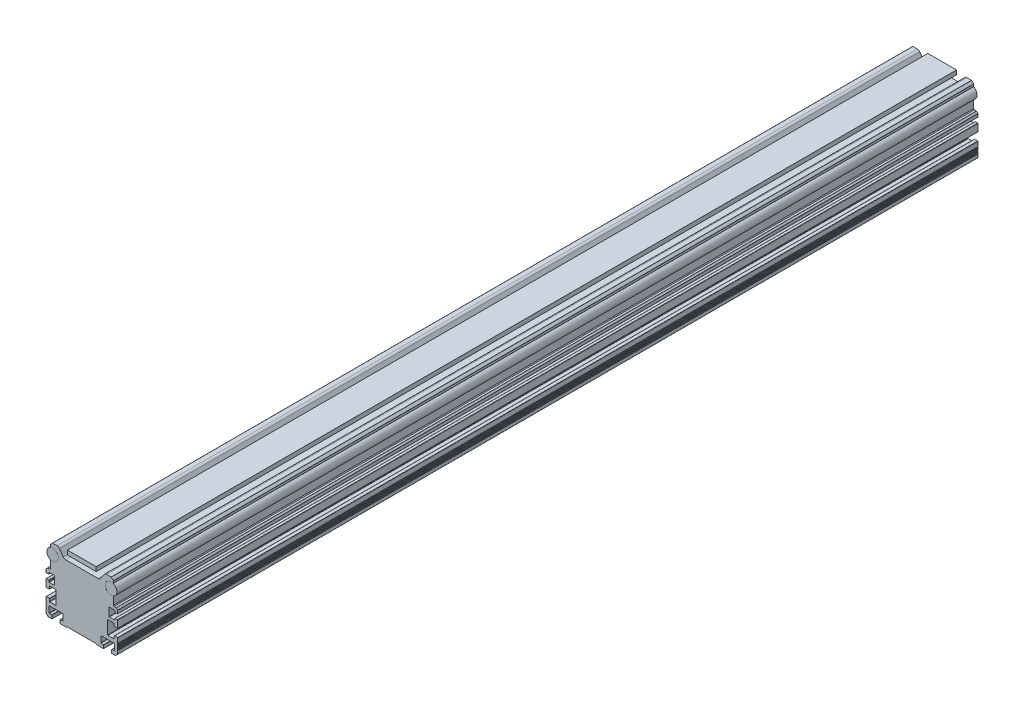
SolidWorks part; units mm, degrees
ref_plane "前视基准面" through (0, 0, 0) normal (0, 0, 1) x (1, 0, 0)
ref_plane "上视基准面" through (0, 0, 0) normal (0, 1, 0) x (1, 0, 0)
ref_plane "右视基准面" through (0, 0, 0) normal (1, 0, 0) x (0, 0, -1)
sketch "草图2" plane through (0, 0, 0) normal (0, 0, 1) x (1, 0, 0)
  line L0 (4.0128, 22.0525) -> (4.0128, 16.7123)
  line L1 (4.0128, 16.7123) -> (3.5128, 16.2123)
  line L2 (3.5128, 16.2123) -> (2.0957, 16.2123)
  line L3 (1.9542, 16.1537) -> (1.0714, 15.2708)
  line L4 (1.0128, 15.1294) -> (1.0128, 13.1062)
  line L5 (1.0128, 9.2062) -> (1.0128, 4.2623)
  line L6 (1.2128, 4.0623) -> (3.3128, 4.0623)
  line L7 (3.5128, 4.2623) -> (3.5128, 5.8618)
  line L8 (3.7128, 6.0623) -> (7.8128, 6.0623)
  line L9 (8.0128, 5.8623) -> (8.0128, -3.2377)
  line L10 (7.8128, -3.4377) -> (3.7128, -3.4377)
  line L11 (3.5128, -3.2371) -> (3.5128, -1.6377)
  line L12 (3.3128, -1.4377) -> (1.2128, -1.4377)
  line L13 (1.0128, -1.6377) -> (1.0128, -11.4049)
  line L14 (1.0714, -11.5463) -> (2.4542, -12.9292)
  line L15 (2.5957, -12.9877) -> (5.0628, -12.9877)
  line L16 (5.2628, -12.7877) -> (5.2628, -10.6877)
  line L17 (5.0628, -10.4877) -> (3.4628, -10.4877)
  line L18 (3.2628, -10.2877) -> (3.2628, -6.1877)
  line L19 (3.4628, -5.9877) -> (12.5628, -5.9877)
  line L20 (12.7628, -6.1877) -> (12.7628, -10.2877)
  line L21 (12.5628, -10.4877) -> (10.9628, -10.4877)
  line L22 (10.7628, -10.6877) -> (10.7628, -12.7877)
  line L23 (10.9628, -12.9877) -> (15.43, -12.9877)
  line L24 (15.5714, -12.9292) -> (16.0128, -12.4877)
  line L25 (16.0128, -12.4877) -> (26.0128, -12.4877)
  line L26 (26.0128, 27.5123) -> (14.669, 27.5123)
  line L27 (13.0307, 28.3651) -> (10.3739, 32.1594)
  line L28 (8.7356, 33.0123) -> (5.5957, 33.0123)
  line L29 (5.4542, 32.9537) -> (4.0714, 31.5708)
  line L30 (4.0128, 31.4294) -> (4.0128, 29.9721)
  line L46 (1.2128, 12.9062) -> (2.8128, 12.9062)
  line L47 (3.0128, 13.9562) -> (3.0128, 13.1062)
  line L48 (3.0128, 9.2062) -> (3.0128, 8.3562)
  line L49 (7.0128, 13.9562) -> (7.0128, 8.3562)
  line L50 (2.8128, 9.4062) -> (1.2128, 9.4062)
  line L51 (3.2128, 8.1562) -> (6.8128, 8.1562)
  line L52 (3.2128, 14.1562) -> (6.8128, 14.1562)
  line L53 (48.0128, 22.0525) -> (48.0128, 16.7123)
  line L54 (48.0128, 16.7123) -> (48.5128, 16.2123)
  line L55 (48.5128, 16.2123) -> (49.93, 16.2123)
  line L56 (50.0714, 16.1537) -> (50.9542, 15.2708)
  line L57 (51.0128, 15.1294) -> (51.0128, 13.1062)
  line L58 (51.0128, 9.2062) -> (51.0128, 4.2623)
  line L59 (50.8128, 4.0623) -> (48.7128, 4.0623)
  line L60 (48.5128, 4.2623) -> (48.5128, 5.8618)
  line L61 (48.3128, 6.0623) -> (44.2128, 6.0623)
  line L62 (44.0128, 5.8623) -> (44.0128, -3.2377)
  line L63 (44.2128, -3.4377) -> (48.3128, -3.4377)
  line L64 (48.5128, -3.2371) -> (48.5128, -1.6377)
  line L65 (48.7128, -1.4377) -> (50.8128, -1.4377)
  line L66 (51.0128, -1.6377) -> (51.0128, -11.4049)
  line L67 (50.9542, -11.5463) -> (49.5714, -12.9292)
  line L68 (49.43, -12.9877) -> (46.9628, -12.9877)
  line L69 (46.7628, -12.7877) -> (46.7628, -10.6877)
  line L70 (46.9628, -10.4877) -> (48.5628, -10.4877)
  line L71 (48.7628, -10.2877) -> (48.7628, -6.1877)
  line L72 (48.5628, -5.9877) -> (39.4628, -5.9877)
  line L73 (39.2628, -6.1877) -> (39.2628, -10.2877)
  line L74 (39.4628, -10.4877) -> (41.0628, -10.4877)
  line L75 (41.2628, -10.6877) -> (41.2628, -12.7877)
  line L76 (41.0628, -12.9877) -> (36.5957, -12.9877)
  line L77 (36.4542, -12.9292) -> (36.0128, -12.4877)
  line L78 (36.0128, -12.4877) -> (26.0128, -12.4877)
  line L79 (26.0128, 27.5123) -> (37.3566, 27.5123)
  line L80 (38.9949, 28.3651) -> (41.6518, 32.1594)
  line L81 (43.2901, 33.0123) -> (46.43, 33.0123)
  line L82 (46.5714, 32.9537) -> (47.9542, 31.5708)
  line L83 (48.0128, 31.4294) -> (48.0128, 29.9721)
  line L99 (50.8128, 12.9062) -> (49.2128, 12.9062)
  line L100 (49.0128, 13.9562) -> (49.0128, 13.1062)
  line L101 (49.0128, 9.2062) -> (49.0128, 8.3562)
  line L102 (45.0128, 13.9562) -> (45.0128, 8.3562)
  line L103 (49.2128, 9.4062) -> (50.8128, 9.4062)
  line L104 (48.8128, 8.1562) -> (45.2128, 8.1562)
  line L105 (48.8128, 14.1562) -> (45.2128, 14.1562)
  arc A0 (4.2795, 22.241) -> (8.7029, 23.4724) centre (5.6128, 26.0123) ccw
  arc A1 (8.9955, 23.8775) -> (8.9955, 28.147) centre (5.6128, 26.0123) ccw
  arc A2 (8.7029, 28.5522) -> (4.2795, 29.7835) centre (5.6128, 26.0123) ccw
  arc A3 (4.2795, 22.241) -> (4.0128, 22.0525) centre (4.2128, 22.0525) ccw
  arc A4 (2.0957, 16.2123) -> (1.9542, 16.1537) centre (2.0957, 16.0123) ccw
  arc A5 (1.0714, 15.2708) -> (1.0128, 15.1294) centre (1.2128, 15.1294) ccw
  arc A6 (1.0128, 13.1062) -> (1.2128, 12.9062) centre (1.2128, 13.1062) ccw
  arc A7 (1.2128, 9.4062) -> (1.0128, 9.2062) centre (1.2128, 9.2062) ccw
  arc A8 (1.0128, 4.2623) -> (1.2128, 4.0623) centre (1.2128, 4.2623) ccw
  arc A9 (3.3128, 4.0623) -> (3.5128, 4.2623) centre (3.3128, 4.2623) ccw
  arc A10 (3.7128, 6.0623) -> (3.5128, 5.8618) centre (3.7128, 5.8623) ccw
  arc A11 (8.0128, 5.8623) -> (7.8128, 6.0623) centre (7.8128, 5.8623) ccw
  arc A12 (7.8128, -3.4377) -> (8.0128, -3.2377) centre (7.8128, -3.2377) ccw
  arc A13 (3.5128, -3.2371) -> (3.7128, -3.4377) centre (3.7128, -3.2377) ccw
  arc A14 (3.5128, -1.6377) -> (3.3128, -1.4377) centre (3.3128, -1.6377) ccw
  arc A15 (1.2128, -1.4377) -> (1.0128, -1.6377) centre (1.2128, -1.6377) ccw
  arc A16 (1.0128, -11.4049) -> (1.0714, -11.5463) centre (1.2128, -11.4049) ccw
  arc A17 (2.4542, -12.9292) -> (2.5957, -12.9877) centre (2.5957, -12.7877) ccw
  arc A18 (5.0628, -12.9877) -> (5.2628, -12.7877) centre (5.0628, -12.7877) ccw
  arc A19 (5.2628, -10.6877) -> (5.0628, -10.4877) centre (5.0628, -10.6877) ccw
  arc A20 (3.2628, -10.2877) -> (3.4628, -10.4877) centre (3.4628, -10.2877) ccw
  arc A21 (3.4628, -5.9877) -> (3.2628, -6.1877) centre (3.4628, -6.1877) ccw
  arc A22 (12.7628, -6.1877) -> (12.5628, -5.9877) centre (12.5628, -6.1877) ccw
  arc A23 (12.5628, -10.4877) -> (12.7628, -10.2877) centre (12.5628, -10.2877) ccw
  arc A24 (10.9628, -10.4877) -> (10.7628, -10.6877) centre (10.9628, -10.6877) ccw
  arc A25 (10.7628, -12.7877) -> (10.9628, -12.9877) centre (10.9628, -12.7877) ccw
  arc A26 (15.43, -12.9877) -> (15.5714, -12.9292) centre (15.43, -12.7877) ccw
  arc A27 (13.0307, 28.3651) -> (14.669, 27.5123) centre (14.669, 29.5123) ccw
  arc A28 (10.3739, 32.1594) -> (8.7356, 33.0123) centre (8.7356, 31.0123) ccw
  arc A29 (5.5957, 33.0123) -> (5.4542, 32.9537) centre (5.5957, 32.8123) ccw
  arc A30 (4.0714, 31.5708) -> (4.0128, 31.4294) centre (4.2128, 31.4294) ccw
  arc A31 (4.0128, 29.9721) -> (4.2795, 29.7835) centre (4.2128, 29.9721) ccw
  arc A49 (2.8128, 12.9062) -> (3.0128, 13.1062) centre (2.8128, 13.1062) ccw
  arc A50 (3.2128, 14.1562) -> (3.0128, 13.9562) centre (3.2128, 13.9562) ccw
  arc A51 (3.0128, 9.2062) -> (2.8128, 9.4062) centre (2.8128, 9.2062) ccw
  arc A52 (6.8128, 8.1562) -> (7.0128, 8.3562) centre (6.8128, 8.3562) ccw
  arc A53 (3.0128, 8.3562) -> (3.2128, 8.1562) centre (3.2128, 8.3562) ccw
  arc A54 (7.0128, 13.9562) -> (6.8128, 14.1562) centre (6.8128, 13.9562) ccw
  arc A55 (8.7029, 23.4724) -> (8.9955, 23.8775) centre (8.8556, 23.6704) ccw
  arc A56 (8.9955, 28.147) -> (8.7029, 28.5522) centre (8.8556, 28.3542) ccw
  arc A57 (43.3227, 23.4724) -> (47.7462, 22.241) centre (46.4128, 26.0123) ccw
  arc A58 (43.0301, 28.147) -> (43.0301, 23.8775) centre (46.4128, 26.0123) ccw
  arc A59 (47.7462, 29.7835) -> (43.3227, 28.5522) centre (46.4128, 26.0123) ccw
  arc A60 (48.0128, 22.0525) -> (47.7462, 22.241) centre (47.8128, 22.0525) ccw
  arc A61 (50.0714, 16.1537) -> (49.93, 16.2123) centre (49.93, 16.0123) ccw
  arc A62 (51.0128, 15.1294) -> (50.9542, 15.2708) centre (50.8128, 15.1294) ccw
  arc A63 (50.8128, 12.9062) -> (51.0128, 13.1062) centre (50.8128, 13.1062) ccw
  arc A64 (51.0128, 9.2062) -> (50.8128, 9.4062) centre (50.8128, 9.2062) ccw
  arc A65 (50.8128, 4.0623) -> (51.0128, 4.2623) centre (50.8128, 4.2623) ccw
  arc A66 (48.5128, 4.2623) -> (48.7128, 4.0623) centre (48.7128, 4.2623) ccw
  arc A67 (48.5128, 5.8618) -> (48.3128, 6.0623) centre (48.3128, 5.8623) ccw
  arc A68 (44.2128, 6.0623) -> (44.0128, 5.8623) centre (44.2128, 5.8623) ccw
  arc A69 (44.0128, -3.2377) -> (44.2128, -3.4377) centre (44.2128, -3.2377) ccw
  arc A70 (48.3128, -3.4377) -> (48.5128, -3.2371) centre (48.3128, -3.2377) ccw
  arc A71 (48.7128, -1.4377) -> (48.5128, -1.6377) centre (48.7128, -1.6377) ccw
  arc A72 (51.0128, -1.6377) -> (50.8128, -1.4377) centre (50.8128, -1.6377) ccw
  arc A73 (50.9542, -11.5463) -> (51.0128, -11.4049) centre (50.8128, -11.4049) ccw
  arc A74 (49.43, -12.9877) -> (49.5714, -12.9292) centre (49.43, -12.7877) ccw
  arc A75 (46.7628, -12.7877) -> (46.9628, -12.9877) centre (46.9628, -12.7877) ccw
  arc A76 (46.9628, -10.4877) -> (46.7628, -10.6877) centre (46.9628, -10.6877) ccw
  arc A77 (48.5628, -10.4877) -> (48.7628, -10.2877) centre (48.5628, -10.2877) ccw
  arc A78 (48.7628, -6.1877) -> (48.5628, -5.9877) centre (48.5628, -6.1877) ccw
  arc A79 (39.4628, -5.9877) -> (39.2628, -6.1877) centre (39.4628, -6.1877) ccw
  arc A80 (39.2628, -10.2877) -> (39.4628, -10.4877) centre (39.4628, -10.2877) ccw
  arc A81 (41.2628, -10.6877) -> (41.0628, -10.4877) centre (41.0628, -10.6877) ccw
  arc A82 (41.0628, -12.9877) -> (41.2628, -12.7877) centre (41.0628, -12.7877) ccw
  arc A83 (36.4542, -12.9292) -> (36.5957, -12.9877) centre (36.5957, -12.7877) ccw
  arc A84 (37.3566, 27.5123) -> (38.9949, 28.3651) centre (37.3566, 29.5123) ccw
  arc A85 (43.2901, 33.0123) -> (41.6518, 32.1594) centre (43.2901, 31.0123) ccw
  arc A86 (46.5714, 32.9537) -> (46.43, 33.0123) centre (46.43, 32.8123) ccw
  arc A87 (48.0128, 31.4294) -> (47.9542, 31.5708) centre (47.8128, 31.4294) ccw
  arc A88 (47.7462, 29.7835) -> (48.0128, 29.9721) centre (47.8128, 29.9721) ccw
  arc A106 (49.0128, 13.1062) -> (49.2128, 12.9062) centre (49.2128, 13.1062) ccw
  arc A107 (49.0128, 13.9562) -> (48.8128, 14.1562) centre (48.8128, 13.9562) ccw
  arc A108 (49.2128, 9.4062) -> (49.0128, 9.2062) centre (49.2128, 9.2062) ccw
  arc A109 (45.0128, 8.3562) -> (45.2128, 8.1562) centre (45.2128, 8.3562) ccw
  arc A110 (48.8128, 8.1562) -> (49.0128, 8.3562) centre (48.8128, 8.3562) ccw
  arc A111 (45.2128, 14.1562) -> (45.0128, 13.9562) centre (45.2128, 13.9562) ccw
  arc A112 (43.0301, 23.8775) -> (43.3227, 23.4724) centre (43.1701, 23.6704) ccw
  arc A113 (43.3227, 28.5522) -> (43.0301, 28.147) centre (43.1701, 28.3542) ccw
extrude "凸台-拉伸1" add sketch "草图2" along normal blind 600
sketch "草图3" plane through (0, 0, 600) normal (0, 0, 1) x (1, 0, 0)
  line L0 (1.0128, -1.6377) -> (1.0128, -11.4049) construction
  line L1 (2.5957, -12.9877) -> (5.0628, -12.9877) construction
  line L2 (26.0128, -12.4877) -> (26.0128, -3.2692) construction
  line L3 (16.0128, -12.4877) -> (36.0128, -12.4877) construction
  circle A0 centre (1.0128, -8.9877) radius 0.25
  circle A1 centre (1.0128, -7.9877) radius 0.25
  circle A2 centre (1.0128, -6.9877) radius 0.25
  circle A3 centre (1.0128, -5.9877) radius 0.25
  circle A4 centre (1.0128, -4.9877) radius 0.25
  circle A5 centre (51.0128, -4.9877) radius 0.25
  circle A6 centre (51.0128, -5.9877) radius 0.25
  circle A7 centre (51.0128, -6.9877) radius 0.25
  circle A8 centre (51.0128, -7.9877) radius 0.25
  circle A9 centre (51.0128, -8.9877) radius 0.25
  dimension "D1" = 4
  dimension "D2" = 0.5
  dimension "D3" = 5
extrude "切除-拉伸1" cut sketch "草图3" against normal through all
sketch "草图5" plane through (0, 0, 600) normal (0, 0, 1) x (1, 0, 0)
  circle A0 centre (5.6128, 26.0123) radius 4
  circle A1 centre (46.4128, 26.0123) radius 4
extrude "凸台-拉伸2" add sketch "草图5" against normal up to surface (600 mm away) separate body
sketch "草图6" plane through (0, 0, 600) normal (0, 0, 1) x (1, 0, 0)
  line L0 (26.0128, 27.5123) -> (26.0128, 36.2305) construction
  line L1 (16.0128, 34.0123) -> (36.0128, 34.0123)
  line L2 (16.0128, 34.0123) -> (16.0128, 31.0123)
  line L3 (16.0128, 31.0123) -> (36.0128, 31.0123)
  line L4 (36.0128, 34.0123) -> (36.0128, 31.0123)
  line L5 (37.3566, 27.5123) -> (14.669, 27.5123) construction
  dimension "D1" = 3
  dimension "D2" = 20
  dimension "D3" = 3.5
extrude "凸台-拉伸3" add sketch "草图6" against normal up to surface (600 mm away) separate body
